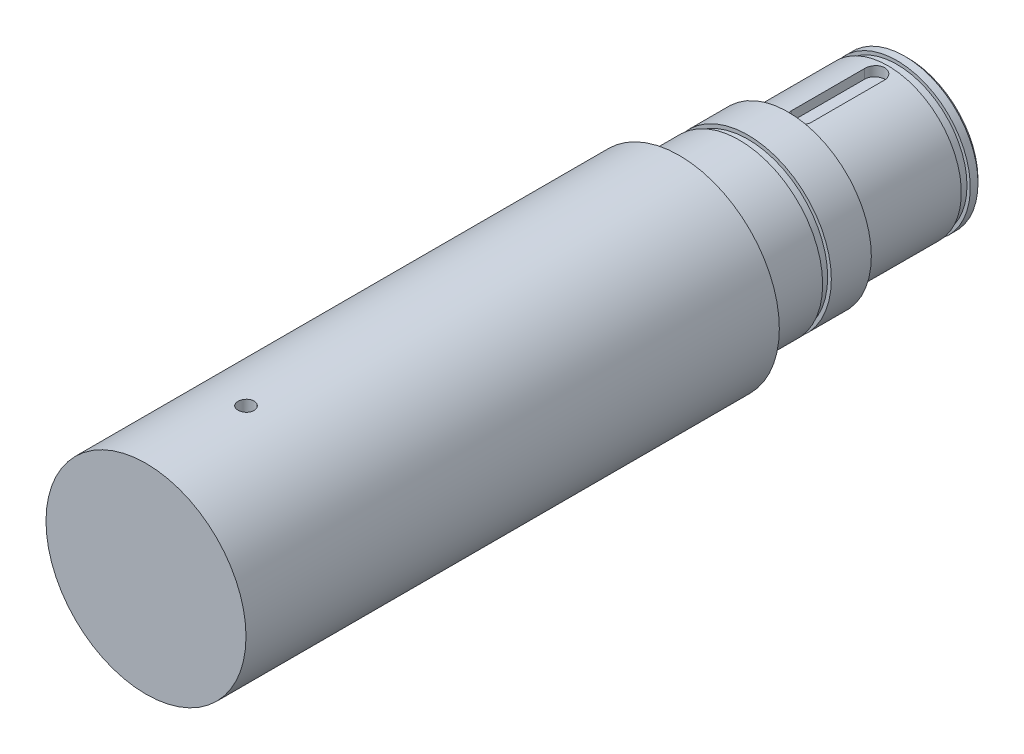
SolidWorks part; units mm, degrees
ref_plane "Plan de face" through (0, 0, 0) normal (0, 0, 1) x (1, 0, 0)
ref_plane "Plan de dessus" through (0, 0, 0) normal (0, 1, 0) x (1, 0, 0)
ref_plane "Plan de droite" through (0, 0, 0) normal (1, 0, 0) x (0, 0, -1)
sketch "Esquisse1" plane through (0, 0, 0) normal (0, 0, 1) x (1, 0, 0)
  circle A0 centre (0, 0) radius 11
  dimension "D1" = 22
extrude "Extrusion1" add sketch "Esquisse1" along normal blind 18
sketch "Esquisse5" plane through (0, 0, 18) normal (0, 0, 1) x (1, 0, 0)
  circle A0 centre (0, 0) radius 12.5
  dimension "D1" = 25
extrude "Extrusion5" add sketch "Esquisse5" along normal blind 6
sketch "Esquisse6" plane through (0, 0, 24) normal (0, 0, 1) x (1, 0, 0)
  circle A0 centre (0, 0) radius 11.95
  dimension "D1" = 23.9
extrude "Extrusion6" add sketch "Esquisse6" along normal blind 1.3
sketch "Esquisse7" plane through (0, 0, 25.3) normal (0, 0, 1) x (1, 0, 0)
  circle A0 centre (0, 0) radius 12.5
extrude "Extrusion7" add sketch "Esquisse7" along normal blind 9
sketch "Esquisse8" plane through (0, 0, 34.3) normal (0, 0, 1) x (1, 0, 0)
  circle A0 centre (0, 0) radius 15
  dimension "D1" = 30
extrude "Extrusion8" add sketch "Esquisse8" along normal blind 80
ref_plane "Plan1" through (0, 0, 3) normal (0, 0, -1) x (-1, 0, 0)
sketch "Esquisse9" plane through (0, 0, 3) normal (0, 0, -1) x (-1, 0, 0)
  circle A0 centre (0, 0) radius 10.5
  dimension "D1" = 21
extrude "Enlèv. mat.-Extru.1" cut sketch "Esquisse9" along normal blind 1.35 flip side to cut
chamfer "Chanfrein1" distance 0.5 angle 45 1 edges at (11, 0, 0)
ref_plane "Plan2" through (0, 11, 0) normal (0, 1, 0) x (-1, 0, 0)
sketch "Esquisse10" plane through (0, 11, 0) normal (0, 1, 0) x (-1, 0, 0)
  line L0 (-11, 3) -> (11, 3) construction
  line L1 (-1.5, 5) -> (-1.5, 16)
  line L2 (1.5, 5) -> (1.5, 16)
  arc A0 (-1.5, 5) -> (1.5, 5) centre (0, 5) ccw
  arc A1 (1.5, 16) -> (-1.5, 16) centre (0, 16) ccw
  dimension "D1" = 3
  dimension "D2" = 2
  dimension "D3" = 11
  dimension "D4" = 11
extrude "Enlèv. mat.-Extru.2" cut sketch "Esquisse10" against normal blind 1.5
ref_plane "Plan3" through (0, 15, 0) normal (0, 1, 0) x (-1, 0, 0)
hole_wizard "Dégagement M21" positions "Esquisse12" profile "Esquisse11" hole size "M2" standard "ISO"
sketch "Esquisse12" plane through (0, 15, 0) normal (0, 1, 0) x (-1, 0, 0)
  line L0 (15, 114.3) -> (-15, 114.3) construction
  line L1 (-12.5, 34.3) -> (-12.5, 25.3) construction
  point P0 (0, 99.3)
  dimension "D1" = 15
  dimension "D2" = 12.5
sketch "Esquisse11" plane through (0, 15, 99.3) normal (1, 0, 0) x (0, 0, 1)
  line L0 (0, 0) -> (0, 70.721)
  line L1 (0, 70.721) -> (1.2, 70)
  line L2 (1.2, 70) -> (1.2, 0)
  line L5 (1.2, 0) -> (0, 0)
  line L10 (0, 70.721) -> (-1.2, 70) construction
  line L11 (0, -6.35) -> (0, 107.95) construction
  dimension "Diamètre du perçage" = 2.4
  dimension "Profondeur du perçage" = 70
  dimension "Angle de pointe" = 118
